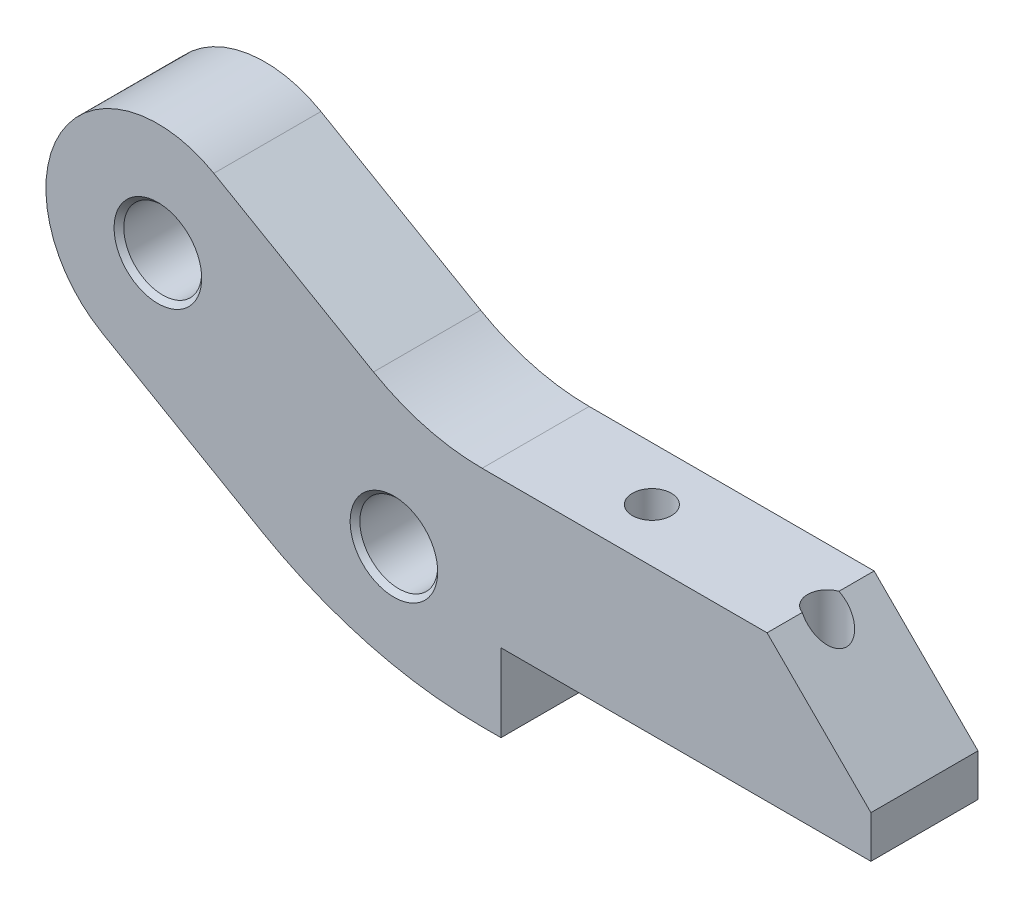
SolidWorks part; units mm, degrees
ref_plane "Plane1" through (0, 0, 0) normal (0, 0, 1) x (1, 0, 0)
ref_plane "Plane2" through (0, 0, 0) normal (0, 1, 0) x (1, 0, 0)
ref_plane "Plane3" through (0, 0, 0) normal (1, 0, 0) x (0, 0, -1)
sketch "Esquisse1" plane through (0, 0, 0) normal (0, 0, 1) x (1, 0, 0)
  line L0 (23.0593, 31.5) -> (52.3312, 31.5)
  line L1 (11.9045, 34.4889) -> (-4.4987, 43.9593)
  line L2 (-15.9987, 24.0407) -> (0.4045, 14.5703)
  line L3 (23.0593, 8.5) -> (25, 8.5)
  line L4 (25, 8.5) -> (25, 16.5)
  line L5 (25, 16.5) -> (63, 16.5)
  line L6 (63, 16.5) -> (63, 20.8312)
  line L7 (63, 20.8312) -> (52.3312, 31.5)
  line L8 (14, 20) -> (-10.2487, 34) construction
  line L9 (14, 20) -> (65.1624, 20) construction
  arc A0 (23.0593, 31.5) -> (11.9045, 34.4889) centre (23.0593, 53.8096) cw
  arc A1 (-4.4987, 43.9593) -> (-15.9987, 24.0407) centre (-10.2487, 34) ccw
  arc A2 (0.4045, 14.5703) -> (23.0593, 8.5) centre (23.0593, 53.8096) ccw
  dimension "D1" = 23
  dimension "D2" = 23
  dimension "D3" = 8
  dimension "D4" = 30
  dimension "D5" = 28
  dimension "D6" = 11
  dimension "D7" = 49
  dimension "D8" = 225
extrude "Base-Extrusion" add sketch "Esquisse1" along normal blind 11
sketch "Esquisse2" plane through (0, 0, 11) normal (0, 0, 1) x (1, 0, 0)
  circle A0 centre (-10.2487, 34) radius 4
  dimension "D1" = 8
extrude "Enlèv. mat.-Extru.1" cut sketch "Esquisse2" against normal through all
chamfer "Chanfrein1" distance 0.5 angle 45 2 edges at (-6.2487, 34, 0) (-6.2487, 34, 11)
sketch "Esquisse3" plane through (23.4833, -13.4315, 11) normal (0, 0, 1) x (1, 0, 0)
  line L0 (-9.4833, 33.4315) -> (-33.732, 47.4315) construction
  line L2 (-39.482, 37.4723) -> (-23.0789, 28.0019) construction
  circle A0 centre (-9.4833, 33.4315) radius 4
  circle A1 centre (-33.732, 47.4315) radius 4.5 construction
  dimension "D1" = 8
  dimension "D2" = 28
extrude "Enlèv. mat.-Extru.3" cut sketch "Esquisse3" against normal through all
chamfer "Chanfrein2" distance 0.5 angle 45 2 edges at (18, 20, 0) (18, 20, 11)
sketch "Esquisse4" plane through (0, 16.5, 0) normal (0, -1, 0) x (1, 0, 0)
  line L0 (25, 11) -> (25, 0) construction
  line L1 (25, 0) -> (63, 0) construction
  circle A0 centre (35, 5.5) radius 2
  circle A1 centre (53, 5.5) radius 2
  dimension "D1" = 4
  dimension "D2" = 4
  dimension "D6" = 5.5
  dimension "D3" = 10
  dimension "D4" = 18
  dimension "D5" = 5.5
extrude "Enlèv. mat.-Extru.4" cut sketch "Esquisse4" against normal blind 21.8492
